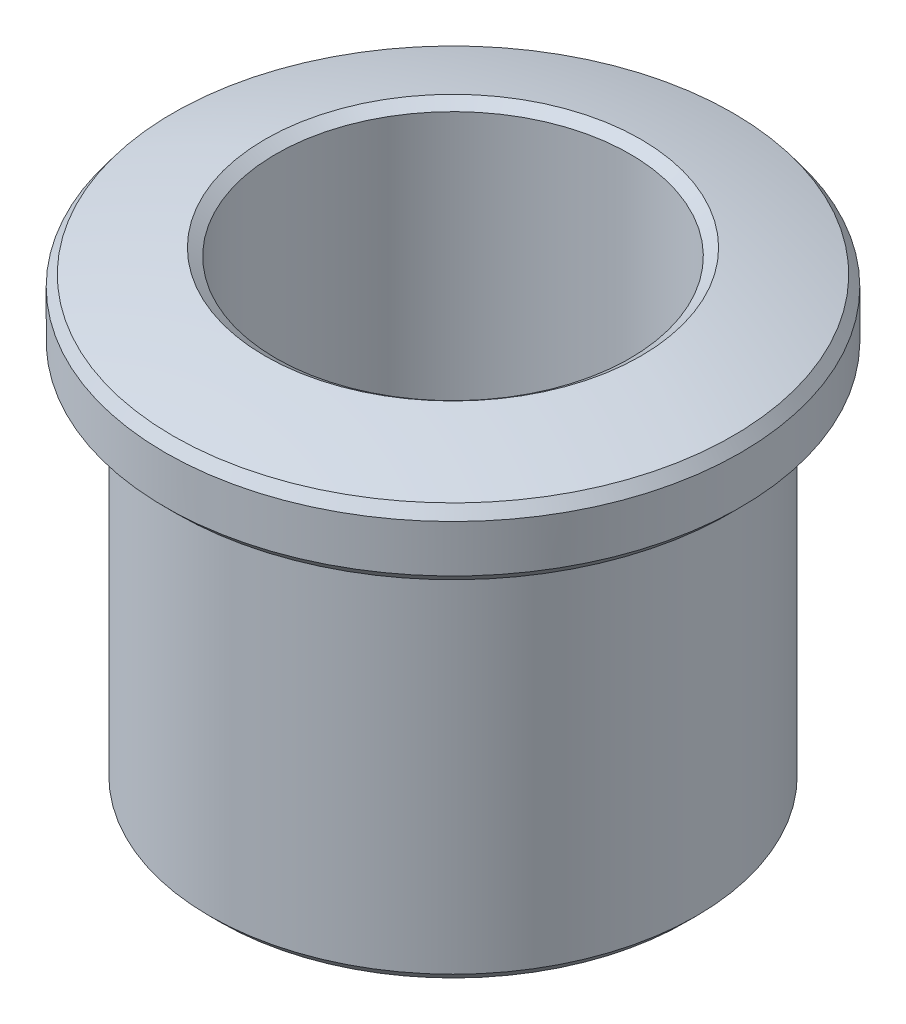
SolidWorks part; units mm, degrees
ref_plane "Face" through (0, 0, 0) normal (0, 0, 1) x (1, 0, 0)
ref_plane "Dessus" through (0, 0, 0) normal (0, 1, 0) x (1, 0, 0)
ref_plane "Profil" through (0, 0, 0) normal (1, 0, 0) x (0, 0, -1)
sketch "Esquisse1" plane through (0, 0, 0) normal (0, 1, 0) x (1, 0, 0)
  circle A0 centre (0, 0) radius 13
  dimension "D1" = 26
extrude "Base-Extrusion" add sketch "Esquisse1" along normal blind 20
dome "Dôme1" faces to dome 1 distance 2 parameters "D1"=2
hole_wizard "Perçage1" positions "Esquisse4" profile "Esquisse3" hole size "M14" standard "ISO"
sketch "Esquisse4" plane through (0, 0, 0) normal (0, -1, 0) x (1, 0, 0)
  circle A0 centre (0, 0) radius 13 construction
  point P0 (0, 0)
sketch "Esquisse3" plane through (0, 0, 0) normal (1, 0, 0) x (0, 0, -1)
  line L0 (0, 0) -> (0, 22)
  line L1 (0, 22) -> (8, 22)
  line L2 (8, 22) -> (8, 0)
  line L5 (8, 0) -> (0, 0)
  line L11 (0, -6.35) -> (0, 107.95) construction
  dimension "Diamètre du perçage jusqu'au prochain" = 16
  dimension "Profondeur du perçage jusqu'au prochain" = 22
sketch "Esquisse2" plane through (0, 0, 0) normal (0, -1, 0) x (1, 0, 0)
  circle A0 centre (0, 0) radius 11
  dimension "D1" = 22
extrude "Enlèv. de mat.-Extru.-Mince1" cut sketch "Esquisse2" against normal blind 17 thin
chamfer "Chanfrein1" distance 0.5 angle 45
chamfer "Chanfrein2" distance 0.5 angle 45
sketch "Esquisse5" plane through (0, 0, 0) normal (0, 1, 0) x (1, 0, 0)
  line L0 (0, 0) -> (0, -31.4672)
  line L1 (0, 0) -> (22.2506, 22.2506)
  arc A0 (0, -31.4672) -> (22.2506, 22.2506) centre (0, 0) ccw
  dimension "D1" = 135
extrude "Coupe" cut sketch "Esquisse5" along normal through all
